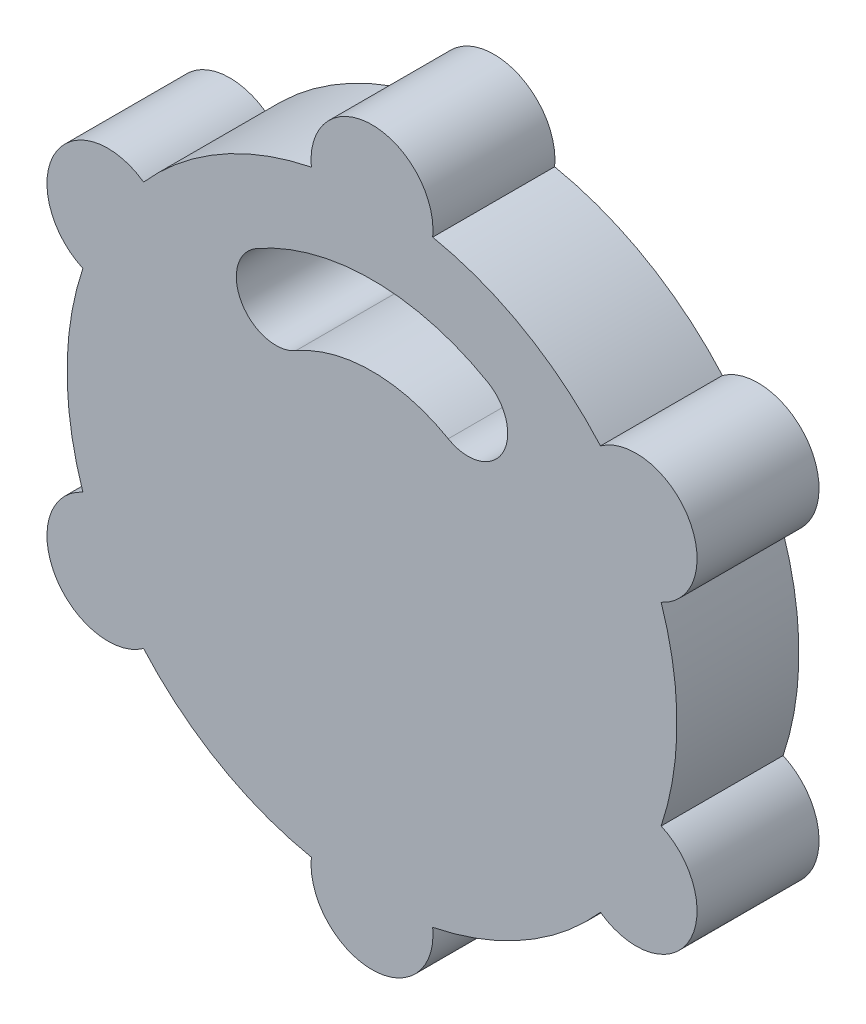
SolidWorks part; units mm, degrees
ref_plane "Plane1" through (0, 0, 0) normal (0, 0, 1) x (1, 0, 0)
ref_plane "Plane2" through (0, 0, 0) normal (0, 1, 0) x (1, 0, 0)
ref_plane "Plane3" through (0, 0, 0) normal (1, 0, 0) x (0, 0, -1)
sketch "Sketch1" plane through (0, 0, 0) normal (0, 0, 1) x (0.866, 0.5, 0)
  arc A0 (49, 9.9499) -> (33.1168, 37.4603) centre (0, 0) ccw
  arc A1 (49, -9.9499) -> (49, 9.9499) centre (50, 0) ccw
  arc A2 (15.8832, -47.4102) -> (33.1168, -37.4603) centre (25, -43.3013) ccw
  arc A3 (-33.1168, -37.4603) -> (-15.8832, -47.4102) centre (-25, -43.3013) ccw
  arc A4 (-49, 9.9499) -> (-49, -9.9499) centre (-50, 0) ccw
  arc A5 (-15.8832, 47.4102) -> (-33.1168, 37.4603) centre (-25, 43.3013) ccw
  arc A6 (33.1168, 37.4603) -> (15.8832, 47.4102) centre (25, 43.3013) ccw
  arc A7 (15.8832, 47.4102) -> (-15.8832, 47.4102) centre (0, 0) ccw
  arc A8 (-33.1168, 37.4603) -> (-49, 9.9499) centre (0, 0) ccw
  arc A9 (-49, -9.9499) -> (-33.1168, -37.4603) centre (0, 0) ccw
  arc A10 (-15.8832, -47.4102) -> (15.8832, -47.4102) centre (0, 0) ccw
  arc A11 (33.1168, -37.4603) -> (49, -9.9499) centre (0, 0) ccw
  arc A12 (21.6506, 12.5) -> (0, 25) centre (0, 0) ccw construction
  arc A13 (32.909, 19) -> (0, 38) centre (0, 0) ccw construction
  arc A14 (0, 38) -> (0, 25) centre (0, 31.5) ccw construction
  arc A15 (21.6506, 12.5) -> (32.909, 19) centre (27.2798, 15.75) ccw construction
  dimension "D1" = 100
  dimension "D4" = 10
  dimension "D5" = 30
  dimension "D6" = 25
  dimension "D8" = 13
  dimension "D7" = 60
extrude "Base-Extrude" add sketch "Sketch1" along normal blind 20
sketch "Sketch2" plane through (0, 0, 20) normal (0, 0, 1) x (1, 0, 0)
  arc A0 (-19, 32.909) -> (-12.5, 21.6506) centre (-15.75, 27.2798) ccw construction
  arc A1 (19, 32.909) -> (-19, 32.909) centre (0, 0) ccw construction
  arc A2 (12.5, 21.6506) -> (19, 32.909) centre (15.75, 27.2798) ccw construction
  arc A3 (12.5, 21.6506) -> (-12.5, 21.6506) centre (0, 0) ccw construction
  arc A4 (-19, 32.909) -> (-12.5, 21.6506) centre (-15.75, 27.2798) ccw
  arc A5 (19, 32.909) -> (-19, 32.909) centre (0, 0) ccw
  arc A6 (12.5, 21.6506) -> (19, 32.909) centre (15.75, 27.2798) ccw
  arc A7 (12.5, 21.6506) -> (-12.5, 21.6506) centre (0, 0) ccw
extrude "Cut-Extrude2" cut sketch "Sketch2" against normal through all
